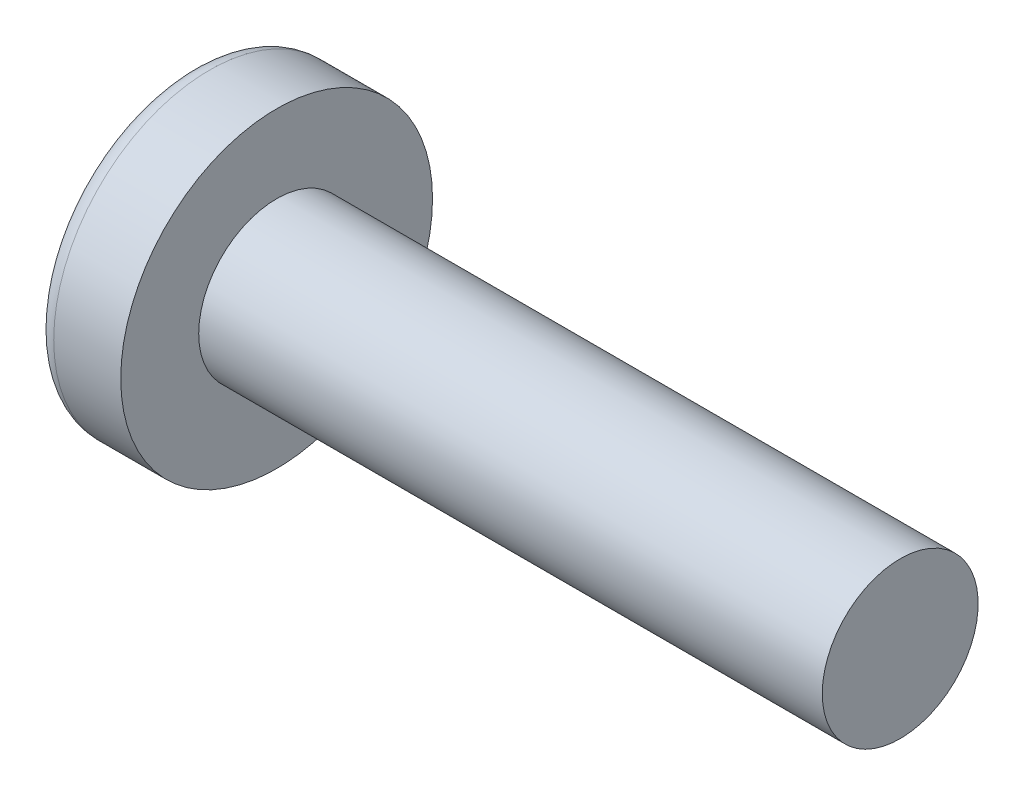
SolidWorks part; units mm, degrees
ref_plane "Plane1" through (0, 0, 0) normal (0, 0, 1) x (1, 0, 0)
ref_plane "Plane2" through (0, 0, 0) normal (0, 1, 0) x (1, 0, 0)
ref_plane "Plane3" through (0, 0, 0) normal (1, 0, 0) x (0, 0, -1)
sketch "BodySke" plane through (0, 0, 0) normal (0, 0, 1) x (1, 0, 0)
  line L0 (2.1, 1.25) -> (2.1, 2.5)
  line L1 (2.55, 6.35) -> (2.55, -3.175) construction
  line L2 (-25.4, 0) -> (127, 0) construction
  line L3 (12.1, 0) -> (0, 0)
  line L4 (2.1, 1.25) -> (12.1, 1.25)
  line L5 (12.1, 1.25) -> (12.1, 0)
  line L6 (1.0251, 2.5) -> (2.1, 2.5)
  line L7 (2.1, -1.25) -> (12.1, -1.25) construction
  line L8 (2.1, 6.35) -> (2.1, -3.175) construction
  arc A0 (0.7839, 2.3784) -> (0, 0) centre (4, 0) ccw
  arc A2 (0.7839, 2.3784) -> (1.0251, 2.5) centre (1.0251, 2.2) cw
  dimension "Head_fillet_rad" = 0.3
  dimension "Head_crown_rad" = 4
  dimension "Head_ht" = 2.1
  dimension "Diameter" = 2.5
  dimension "Length" = 10
  dimension "Head_dia" = 5
  dimension "Advance" = 0.45
  dimension "Thread_nom" = 10
revolve "Base-Revolve" add sketch "BodySke" angle 360 about L2
sketch "Sketch3" plane through (0, 0, 0) normal (1, 0, 0) x (0, 0, -1)
  line L0 (0.35, -1.34) -> (-0.35, -1.34)
  line L1 (0.35, -1.34) -> (0.35, 1.34)
  line L2 (-0.35, 1.34) -> (0.35, 1.34)
  line L3 (-0.35, 1.34) -> (-0.35, -1.34)
  dimension "D1" = 1.34
  dimension "Cross_dia" = 2.68
  dimension "D2" = 0.35
  dimension "Cross_width" = 0.7
ref_plane "Plane4" through (1.53, 0, 0) normal (1, 0, 0) x (0, 0, -1)
sketch "Sketch4" plane through (1.53, 0, 0) normal (1, 0, 0) x (0, 0, -1)
  line L0 (0.175, -0.175) -> (-0.175, -0.175)
  line L1 (0.175, -0.175) -> (0.175, 0.175)
  line L2 (-0.175, 0.175) -> (0.175, 0.175)
  line L3 (-0.175, 0.175) -> (-0.175, -0.175)
  dimension "D1" = 0.35
  dimension "D2" = 0.35
  dimension "D3" = 0.175
  dimension "D4" = 0.175
loft "Cut-Loft1" cut profiles "Sketch3", "Sketch4"
pattern_circular "CirPattern1" count 2 every 90 about axis through (0, 0, 0) along (1, 0, 0) of "Cut-Loft1"
sketch "ThdSchSke" plane through (0, 0, 0) normal (0, 0, 1) x (1, 0, 0)
  line L0 (2.55, -0.9965) -> (2.3725, -1.25)
  line L1 (2.55, -0.9965) -> (2.7275, -1.25)
  line L2 (2.7275, -1.25) -> (2.7275, -1.5625)
  line L3 (-3.175, 0) -> (5.1513, 0) construction
  line L5 (2.7275, -1.5625) -> (2.3725, -1.5625)
  line L6 (2.3725, -1.5625) -> (2.3725, -1.25)
  dimension "Thread_minor" = 1.993
  dimension "Diameter" = 2.5
  dimension "Start" = 2.55
  dimension "SideAngle" = 55
  dimension "VeeAngle" = 70
  dimension "Overcut" = 3.125
revolve "ThreadSchematic" [suppressed] cut sketch "ThdSchSke" angle 360 about L3
pattern_linear "ThdSchPat" [suppressed]
equation "\"D1@Sketch3\" = \"Cross_dia@Sketch3\" / 2"
equation "\"D2@Sketch3\" = \"Cross_width@Sketch3\" / 2"
equation "\"D1@Sketch4\" = \"Cross_width@Sketch3\" *.5"
equation "\"D2@Sketch4\" = \"D1@Sketch4\""
equation "\"D3@Sketch4\" = \"D1@Sketch4\" / 2"
equation "\"D4@Sketch4\" = \"D2@Sketch4\" / 2"
equation "\"Thread_length@ThreadCosmetic\" = ((sgn( (\"Length@BodySke\" - \"Advance@BodySke\" ) - \"Thread_nom@BodySke\" )-1)*( (\"Length@BodySke\" - \"Advance@BodySke\" ) - \"Thread_nom@BodySke\" ))/-2+ \"Thread_nom@BodySke\""
equation "\"Thread_minor@ThdSchSke\" = \"Thread_minor@ThreadCosmetic\""
equation "\"Diameter@ThdSchSke\" = \"Diameter@BodySke\""
equation "\"Overcut@ThdSchSke\" = \"Diameter@BodySke\" * 1.25"
equation "\"Start@ThdSchSke\" = \"Head_ht@BodySke\" + \"Length@BodySke\" - \"Thread_length@ThreadCosmetic\"  '---Non-countersunk---"
equation "\"Num_threads@ThdSchPat\" = int( \"Thread_length@ThreadCosmetic\" / \"Advance@BodySke\" + 0.999 )  + 1"
equation "\"Advance@ThdSchPat\" = \"Thread_length@ThreadCosmetic\" /  (\"Num_threads@ThdSchPat\" - 1) 'relax it"
